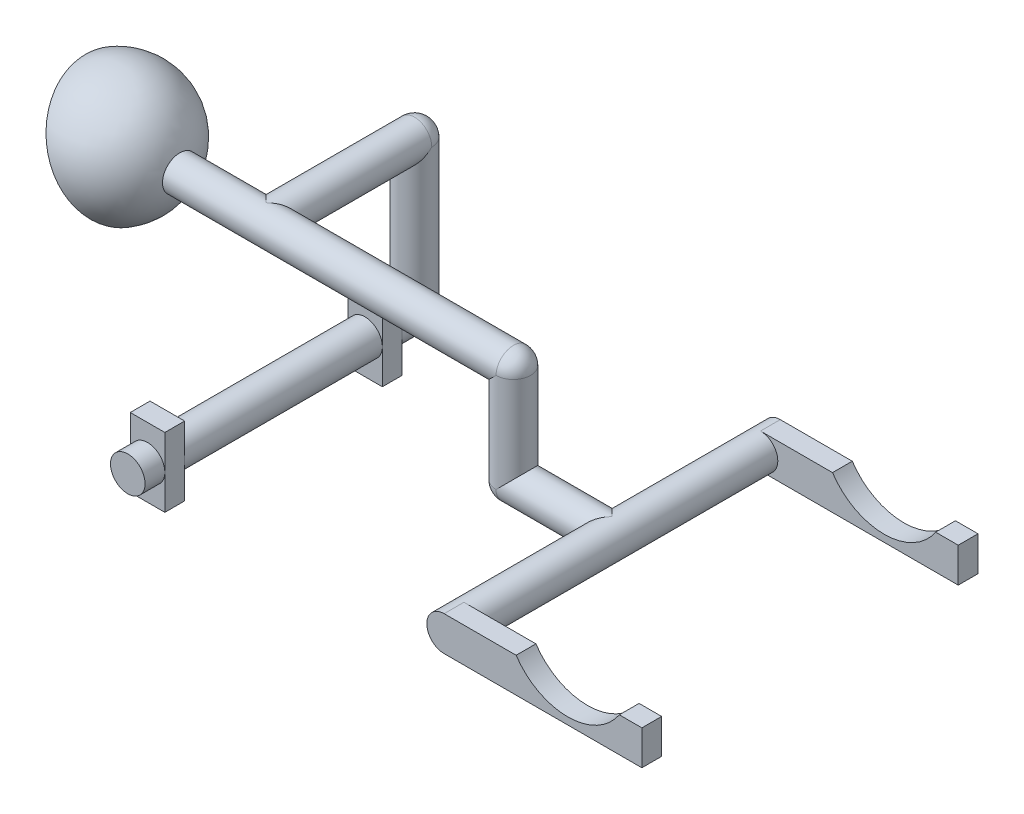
SolidWorks part; units mm, degrees
ref_plane "Face" through (0, 0, 0) normal (0, 0, 1) x (1, 0, 0)
ref_plane "Dessus" through (0, 0, 0) normal (0, 1, 0) x (1, 0, 0)
ref_plane "Droite" through (0, 0, 0) normal (1, 0, 0) x (0, 0, -1)
sketch "Esquisse1" plane through (0, 0, 0) normal (1, 0, 0) x (0, 0, -1)
  circle A0 centre (0, 0) radius 3.5
  dimension "D1" = 7
extrude "Extrusion1" add sketch "Esquisse1" along normal blind 50 and the other way blind 30
sketch "Esquisse2" plane through (0, 0, 0) normal (0, 0, 1) x (1, 0, 0)
  circle A0 centre (0, 0) radius 3.5
extrude "Extrusion2" add sketch "Esquisse2" against normal blind 30
sketch "Esquisse3" plane through (0, 0, 0) normal (0, 1, 0) x (1, 0, 0)
  line L0 (3.5, 30) -> (-3.5, 30) construction
  circle A0 centre (0, 30) radius 3.5
extrude "Extrusion3" add sketch "Esquisse3" against normal blind 30
sketch "Esquisse4" plane through (0, 0, 0) normal (1, 0, 0) x (0, 0, -1)
  line L0 (33.3032, -30) -> (1.9146, -30) construction
  line L1 (26.5, -30) -> (33.5, -30) construction
  line L2 (30, 0) -> (30, 3.5) construction
  line L3 (30, -30) -> (24, -30)
  line L4 (30, -30) -> (30, -26.5)
  line L5 (30, -26.5) -> (24, -26.5)
  line L6 (24, -30) -> (24, -26.5)
  dimension "D1" = 6
  dimension "D2" = 3.5
revolve "Révolution1" add sketch "Esquisse4" angle 360 about L0
sketch "Esquisse5" plane through (0, 0, -24) normal (0, 0, 1) x (1, 0, 0)
  line L1 (3.5, -23) -> (-3.5, -23)
  line L2 (3.5, -23) -> (3.5, -37)
  line L3 (3.5, -37) -> (-3.5, -37)
  line L4 (-3.5, -23) -> (-3.5, -37)
  circle A0 centre (0, -30) radius 3.5 construction
  dimension "D1" = 7
  dimension "D2" = 7
extrude "Extrusion4" add sketch "Esquisse5" along normal blind 4
sketch "Esquisse6" plane through (0, 0, -20) normal (0, 0, 1) x (1, 0, 0)
  arc A0 (-3.5, -30) -> (3.5, -30) centre (0, -30) ccw construction
  arc A1 (-3.5, -30) -> (3.5, -30) centre (0, -30) ccw
  arc A2 (3.5, -30) -> (-3.5, -30) centre (0, -30) ccw construction
  arc A3 (3.5, -30) -> (-3.5, -30) centre (0, -30) ccw
extrude "Extrusion5" add sketch "Esquisse6" along normal blind 40
sketch "Esquisse7" plane through (0, 0, 20) normal (0, 0, 1) x (1, 0, 0)
  line L3 (-3.5, -30) -> (-3.5, -37)
  line L4 (-3.5, -37) -> (3.5, -37)
  line L5 (3.5, -37) -> (3.5, -30)
  line L6 (-3.5, -30) -> (-3.5, -37)
  line L7 (-3.5, -37) -> (3.5, -37)
  line L8 (3.5, -37) -> (3.5, -30)
  line L9 (3.5, -30) -> (3.5, -23)
  line L10 (3.5, -23) -> (-3.5, -23)
  line L11 (-3.5, -23) -> (-3.5, -30)
  line L12 (3.5, -30) -> (3.5, -23)
  line L13 (3.5, -23) -> (-3.5, -23)
  line L14 (-3.5, -23) -> (-3.5, -30)
  arc A1 (-3.5, -30) -> (3.5, -30) centre (0, -30) ccw
  arc A3 (3.5, -30) -> (-3.5, -30) centre (0, -30) ccw
  dimension "D1" = 0
  dimension "D2" = 0
extrude "Extrusion6" add sketch "Esquisse7" along normal blind 4
sketch "Esquisse8" plane through (0, 0, 24) normal (0, 0, 1) x (1, 0, 0)
  arc A0 (-3.5, -30) -> (3.5, -30) centre (0, -30) ccw construction
  arc A1 (-3.5, -30) -> (3.5, -30) centre (0, -30) ccw
  arc A2 (3.5, -30) -> (-3.5, -30) centre (0, -30) ccw construction
  arc A3 (3.5, -30) -> (-3.5, -30) centre (0, -30) ccw
extrude "Extrusion7" add sketch "Esquisse8" along normal blind 4
sketch "Esquisse9" plane through (0, 0, 0) normal (0, 0, 1) x (1, 0, 0)
  line L0 (-30, 3.5) -> (-30, -3.5) construction
  line L1 (-30, 18.6387) -> (-30, -24.2567) construction
  line L2 (-30, 13) -> (-30, -13)
  arc A0 (-30, -13) -> (-30, 13) centre (-30, 0) ccw
  dimension "D1" = 26
revolve "Révolution2" add sketch "Esquisse9" angle 360 about L1
sketch "Esquisse11" plane through (0, 0, 0) normal (0, 1, 0) x (1, 0, 0)
  line L0 (50, -3.5) -> (50, 3.5) construction
  circle A0 centre (50, 0) radius 3.5
extrude "Extrusion8" add sketch "Esquisse11" against normal blind 20
sketch "Esquisse12" plane through (0, 0, 0) normal (0, 0, 1) x (1, 0, 0)
  line L0 (46.5, -20) -> (53.5, -20) construction
  line L1 (50, -20) -> (70, -20)
  line L2 (50, -20) -> (50, -16.5)
  line L3 (50, -16.5) -> (70, -16.5)
  line L4 (70, -20) -> (70, -16.5)
  line L5 (34.9353, -20) -> (99.2277, -20) construction
  dimension "D1" = 20
  dimension "D2" = 3.5
revolve "Révolution3" add sketch "Esquisse12" angle 360 about L5
sketch "Esquisse13" plane through (0, 0, 0) normal (0, 0, 1) x (1, 0, 0)
  line L0 (70, -23.5) -> (70, -16.5) construction
  circle A0 centre (70, -20) radius 3.5
extrude "Extrusion9" add sketch "Esquisse13" along normal blind 30 and the other way blind 30
sketch "Esquisse14" plane through (0, 0, 30) normal (0, 0, 1) x (1, 0, 0)
  line L0 (70, -16.5) -> (84.565, -16.5)
  line L1 (70, -23.5) -> (110, -23.5)
  line L2 (110, -23.5) -> (110, -16.5)
  line L3 (110, -16.5) -> (105.435, -16.5)
  line L4 (70, -16.5) -> (53.5, -16.5) construction
  arc A0 (84.565, -16.5) -> (105.435, -16.5) centre (95, -9.5274) ccw
  circle A1 centre (70, -20) radius 3.5 construction
  arc A2 (70, -16.5) -> (70, -23.5) centre (70, -20) ccw
  dimension "D1" = 15
  dimension "D2" = 40
  dimension "D3" = 7
  dimension "D4" = 7
extrude "Extrusion10" add sketch "Esquisse14" along normal blind 4
mirror "Symétrie1" about plane through (0, 0, 0) normal (0, 0, 1) of "Extrusion10"
sketch "Esquisse15" plane through (0, 0, 0) normal (0, 0, 1) x (1, 0, 0)
  line L0 (-36.5287, 11.2417) -> (-23.4713, -11.2417)
  arc A0 (-17.48, 3.5) -> (-17.48, -3.5) centre (-30, 0) ccw construction
  arc A1 (-36.5287, 11.2417) -> (-23.4713, -11.2417) centre (-30, 0) ccw
extrude "Enlèv. mat.-Extru.1" cut sketch "Esquisse15" against normal blind 24 and the other way blind 24
sketch "Esquisse16" plane through (0, 0, 0) normal (0, 0, 1) x (1, 0, 0)
  line L0 (-36.5287, 11.2417) -> (-23.4713, -11.2417) construction
  line L1 (-45.6009, 0) -> (-12.1301, 0) construction
  line L2 (-40, 0) -> (-20, 0)
  arc A0 (-20, 0) -> (-40, 0) centre (-30, 0) ccw
  dimension "D1" = 20
revolve "Enlèvement de matière-Révolution1" cut sketch "Esquisse16" angle 360 about L1
sketch "Esquisse17" plane through (0, 0, -30) normal (0, 0, -1) x (-1, 0, 0)
  line L0 (-11.8696, 0) -> (11.7271, 0) construction
  line L1 (-3.5, 0) -> (3.5, 0)
  line L2 (-3.5, 0) -> (3.5, 0)
  arc A1 (3.5, 0) -> (-3.5, 0) centre (0, 0) ccw
  arc A2 (3.5, 0) -> (-3.5, 0) centre (0, 0) ccw
  dimension "D1" = 0
revolve "Révolution4" add sketch "Esquisse17" angle 360 about L0
sketch "Esquisse18" plane through (0, 0, -30) normal (0, 0, -1) x (-1, 0, 0)
  line L0 (-8.2364, -30) -> (9.2728, -30) construction
  line L1 (3.5, -30) -> (-3.5, -30)
  line L2 (3.5, -30) -> (-3.5, -30)
  arc A1 (-3.5, -30) -> (3.5, -30) centre (0, -30) ccw
  arc A2 (-3.5, -30) -> (3.5, -30) centre (0, -30) ccw
  dimension "D1" = 0
revolve "Révolution5" add sketch "Esquisse18" angle 360 about L0
sketch "Esquisse19" plane through (50, 0, 0) normal (-1, 0, 0) x (0, 0, 1)
  line L0 (-10.85, -20) -> (10.2919, -20) construction
  line L1 (3.5, -20) -> (-3.5, -20)
  line L2 (3.5, -20) -> (-3.5, -20)
  arc A1 (-3.5, -20) -> (3.5, -20) centre (0, -20) ccw
  arc A2 (-3.5, -20) -> (3.5, -20) centre (0, -20) ccw
  dimension "D1" = 0
revolve "Révolution6" add sketch "Esquisse19" angle 360 about L0
sketch "Esquisse20" plane through (0, 0, 0) normal (0, 1, 0) x (-1, 0, 0)
  line L0 (-50, 14.2283) -> (-50, -12.1611) construction
  line L1 (-50, -3.5) -> (-50, 3.5)
  line L2 (-50, -3.5) -> (-50, 3.5)
  arc A1 (-50, 3.5) -> (-50, -3.5) centre (-50, 0) ccw
  arc A2 (-50, 3.5) -> (-50, -3.5) centre (-50, 0) ccw
  dimension "D1" = 0
revolve "Révolution7" add sketch "Esquisse20" angle 360 about L0
